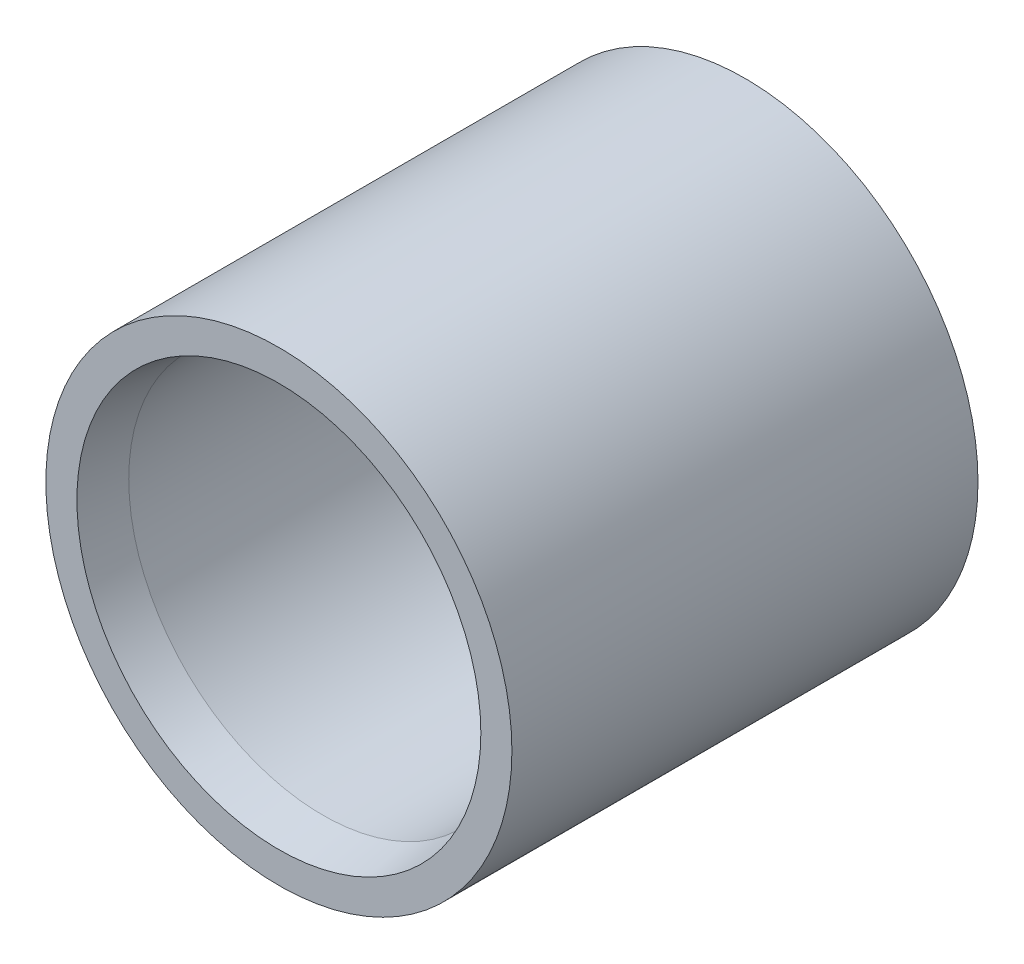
SolidWorks part; units mm, degrees
ref_plane "Face" through (0, 0, 0) normal (0, 0, 1) x (1, 0, 0)
ref_plane "Dessus" through (0, 0, 0) normal (0, 1, 0) x (1, 0, 0)
ref_plane "Droite" through (0, 0, 0) normal (1, 0, 0) x (0, 0, -1)
sketch "Esquisse1" plane through (0, 0, 0) normal (0, 0, 1) x (1, 0, 0)
  circle A0 centre (-15, 28) radius 6 construction
  circle A1 centre (-15, 28) radius 6
  circle A2 centre (-15, 28) radius 5
  dimension "D1" = 10
extrude "Extrusion1" add sketch "Esquisse1" against normal up to surface (12 mm away)
chamfer "Chanfrein1" distance 0.2 angle 80
